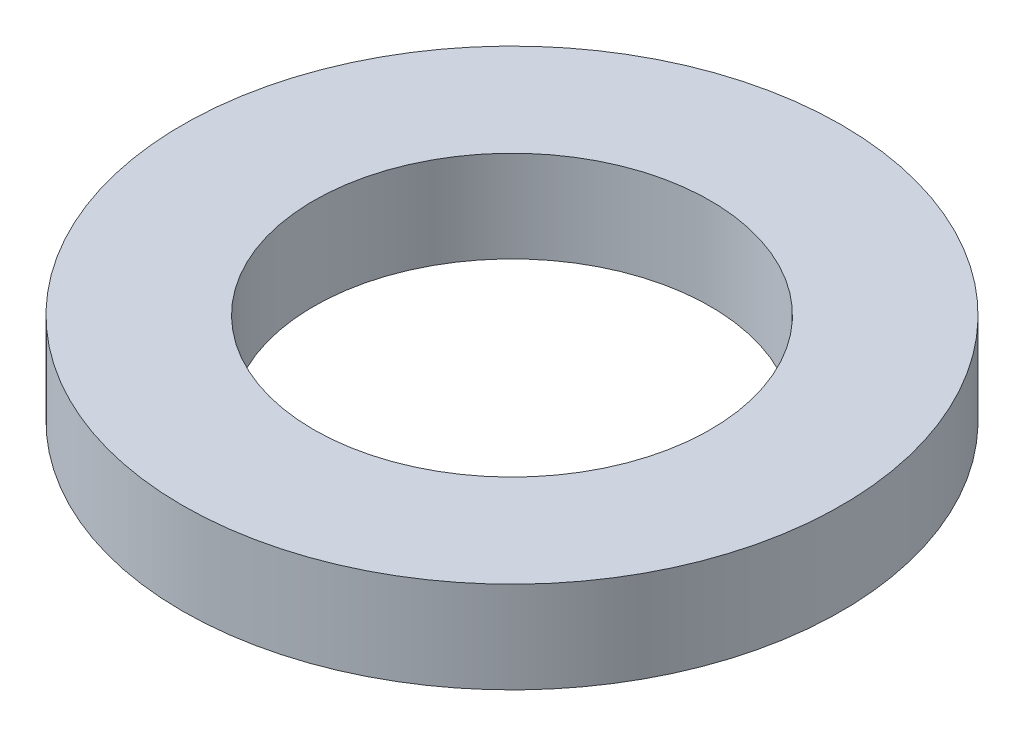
SolidWorks part; units mm, degrees
ref_plane "Piano frontale" through (0, 0, 0) normal (0, 0, 1) x (1, 0, 0)
ref_plane "Piano superiore" through (0, 0, 0) normal (0, 1, 0) x (1, 0, 0)
ref_plane "Piano destro" through (0, 0, 0) normal (1, 0, 0) x (0, 0, -1)
sketch "Schizzo1" plane through (0, 0, 0) normal (0, 1, 0) x (1, 0, 0)
  circle A0 centre (0, 0) radius 5.4
  circle A1 centre (0, 0) radius 3.25
  dimension "D1" = 10.8
  dimension "D2" = 6.5
extrude "Estrusione-Estrusione1" add sketch "Schizzo1" along normal blind 1.5
